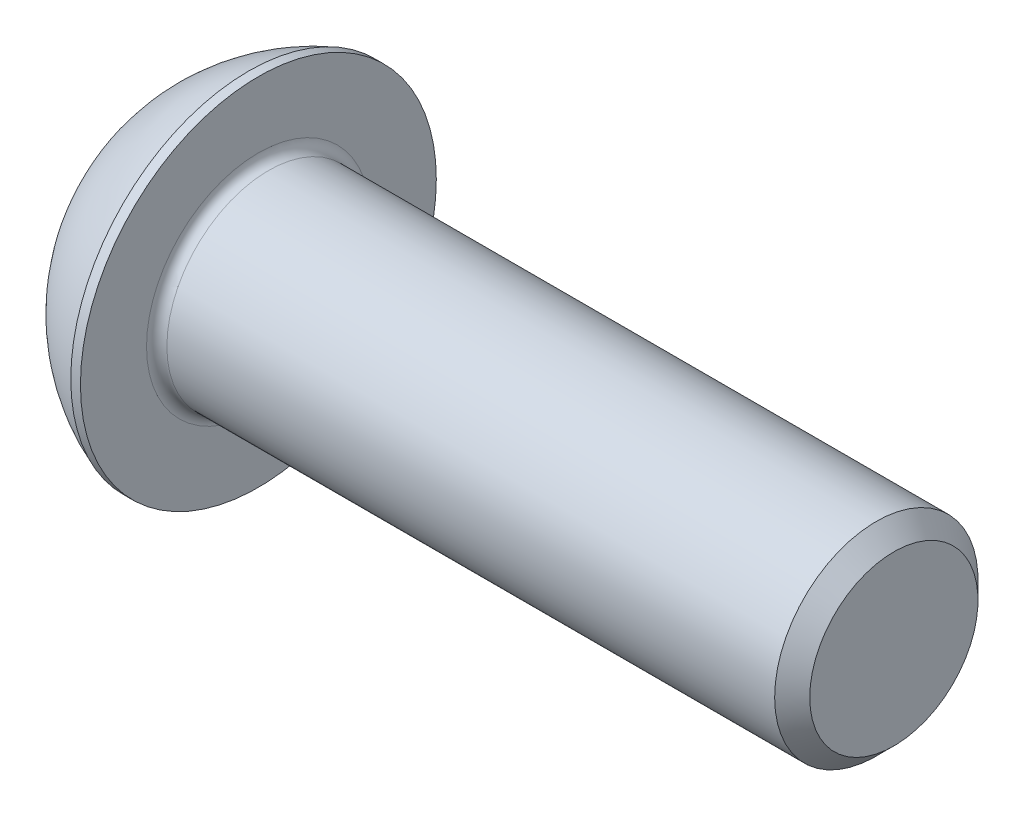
SolidWorks part; units mm, degrees
ref_plane "Plane1" through (0, 0, 0) normal (0, 0, 1) x (1, 0, 0)
ref_plane "Plane2" through (0, 0, 0) normal (0, 1, 0) x (1, 0, 0)
ref_plane "Plane3" through (0, 0, 0) normal (1, 0, 0) x (0, 0, -1)
sketch "BodySke" plane through (0, 0, 0) normal (0, 0, 1) x (1, 0, 0)
  line L0 (29.4, 0) -> (29.4, 3.3095)
  line L1 (28.7095, 4) -> (4.4, 4)
  line L2 (4.4, 4) -> (4.4, 7)
  line L3 (4.4, 7) -> (4.02, 7)
  line L4 (0, 0) -> (101.6, 0) construction
  line L5 (4.4, -7) -> (4.02, -7) construction
  line L6 (55.6768, -4) -> (4.4, -4) construction
  line L7 (29.4, 0) -> (0, 0)
  line L8 (0, 3.5) -> (0, -3.5) construction
  line L9 (0, 0) -> (0, 3.5)
  line L10 (29.4, 3.3095) -> (28.7095, 4)
  line L11 (29.4, -3.3095) -> (28.7095, -4) construction
  line L12 (5.65, 9.525) -> (5.65, -4) construction
  line L13 (4.4, 9.525) -> (4.4, -4) construction
  arc A1 (0, 3.5) -> (4.02, 7) centre (6.5809, 0) cw
revolve "BaseBody" add sketch "BodySke" angle 360 about L4
fillet "Fillet1" radius 0.4 1 edges at (4.4, 0, 4)
sketch "Sketch2" plane through (0, 0, 0) normal (0, 0, 1) x (1, 0, 0)
  line L0 (0, 2.5) -> (2.6, 2.5)
  line L1 (2.6, 2.5) -> (4.0434, 0)
  line L3 (4.0434, 0) -> (0, 0)
  line L4 (0, 0) -> (0, 2.5)
  line L5 (0, -2.5) -> (2.6, -2.5) construction
  line L6 (0, 0) -> (47.625, 0) construction
  dimension "D2" = 60
  dimension "PreBroach_depth" = 2.6
  dimension "PreBroach_dia" = 5
revolve "PreBroach" cut sketch "Sketch2" angle 360 about L6
sketch "Sketch3" plane through (0, 0, 0) normal (1, 0, 0) x (0, 0, -1)
  line L0 (-2.5, -1.4434) -> (-2.5, 1.4434)
  line L1 (-2.5, 1.4434) -> (0, 2.8868)
  line L2 (0, 2.8868) -> (2.5, 1.4434)
  line L3 (2.5, 1.4434) -> (2.5, -1.4434)
  line L4 (2.5, -1.4434) -> (0, -2.8868)
  line L5 (0, -2.8868) -> (-2.5, -1.4434)
extrude "Hex" cut sketch "Sketch3" along normal blind 2.6
sketch "ThdSchSke" plane through (0, 0, 0) normal (0, 0, 1) x (1, 0, 0)
  line L0 (6.9, -3.3095) -> (6.4165, -4)
  line L1 (6.9, -3.3095) -> (7.3835, -4)
  line L2 (7.3835, -4) -> (7.3835, -5)
  line L3 (-3.175, 0) -> (5.1513, 0) construction
  line L5 (7.3835, -5) -> (6.4165, -5)
  line L6 (6.4165, -5) -> (6.4165, -4)
revolve "ThreadSchematic" [suppressed] cut sketch "ThdSchSke" angle 360 about L3
pattern_linear "ThdSchPat" [suppressed]
equation "\"D1@BodySke\" = \"Head_dia@BodySke\" * .5"
equation "\"Thread_minor@ThreadCosmetic\" = \"Minor_dia@BodySke\""
equation "\"D1@Sketch3\" = \"Hex_size@Sketch3\" / 2"
equation "\"D2@Sketch3\" = \"D1@Sketch3\""
equation "\"D3@Sketch3\" = \"Hex_size@Sketch3\""
equation "\"Thread_length@ThreadCosmetic\" = ((sgn( (\"Length@BodySke\" - \"Advance@BodySke\" * 2.0) - \"Thread_nom@BodySke\" )-1)*( (\"Length@BodySke\" - \"Advance@BodySke\" * 2.0) - \"Thread_nom@BodySke\" ))/-2+ \"Thread_no"
equation "\"Thread_minor@ThdSchSke\" = \"Minor_dia@BodySke\""
equation "\"Diameter@ThdSchSke\" = \"Diameter@BodySke\""
equation "\"Overcut@ThdSchSke\" = \"Diameter@BodySke\" * 1.25"
equation "\"Start@ThdSchSke\" = \"Head_ht@BodySke\" + \"Length@BodySke\" - \"Thread_length@ThreadCosmetic\"  '---Non-countersunk---"
equation "\"Num_threads@ThdSchPat\" = int( \"Thread_length@ThreadCosmetic\" / \"Advance@BodySke\" + 0.999 )  + 1"
equation "\"Advance@ThdSchPat\" = \"Thread_length@ThreadCosmetic\" /  (\"Num_threads@ThdSchPat\" - 1) 'relax it"
equation "\"Num_threads@ThdSchPat\" = \"Num_threads@ThdSchPat\" - sgn( \"Num_threads@ThdSchPat\" - 1) '---chamfered tips only---"
